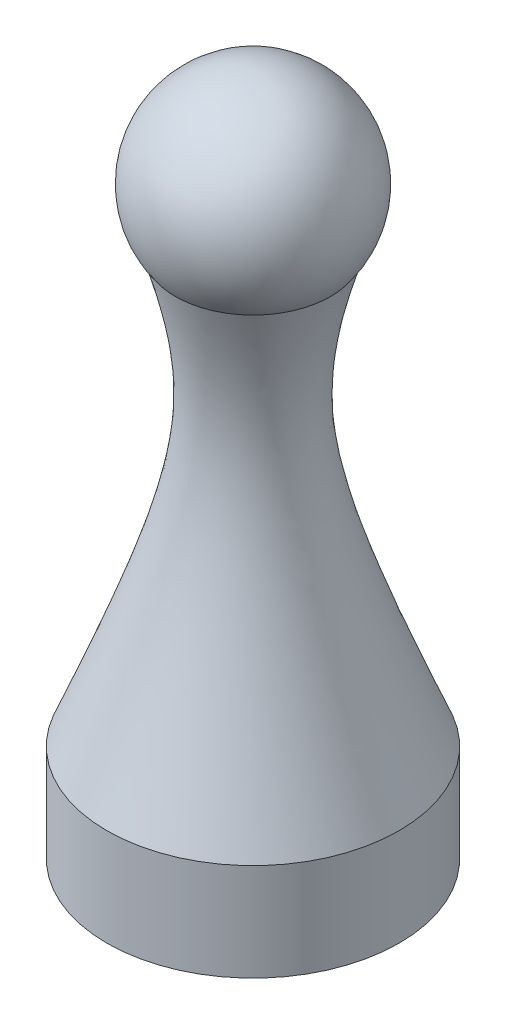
SolidWorks part; units mm, degrees
ref_plane "Front Plane" through (0, 0, 0) normal (0, 0, 1) x (1, 0, 0)
ref_plane "Top Plane" through (0, 0, 0) normal (0, 1, 0) x (1, 0, 0)
ref_plane "Right Plane" through (0, 0, 0) normal (1, 0, 0) x (0, 0, -1)
sketch "Sketch1" plane through (0, 0, 0) normal (0, 1, 0) x (1, 0, 0)
  circle A0 centre (0, 0) radius 15
extrude "Boss-Extrude1" add sketch "Sketch1" along normal blind 10
sketch "Sketch2" plane through (0, 10, 0) normal (0, 1, 0) x (1, 0, 0)
  circle A0 centre (0, 0) radius 15
ref_plane "Plane1" through (0, 60, 0) normal (0, 1, 0) x (1, 0, 0)
sketch "Sketch3" plane through (0, 60, 0) normal (0, 1, 0) x (1, 0, 0)
  circle A0 centre (0, 0) radius 10
loft "Loft1" add profiles "Sketch3", "Sketch2"
sketch "Sketch4" plane through (0, 60, 0) normal (0, 1, 0) x (1, 0, 0)
  line L0 (0, 10) -> (0, -10)
  circle A0 centre (0, 0) radius 10 construction
  arc A1 (0, 10) -> (0, -10) centre (0, 0) cw
revolve "Revolve1" add sketch "Sketch4" angle 360 about L0
sketch "Sketch5" plane through (0, 0, 0) normal (0, -1, 0) x (1, 0, 0)
  line L0 (85.3333, 256) -> (426.6667, 256) construction
  line L1 (70.3333, 241) -> (411.6667, 241) construction
  line L20 (15.5994, -12.313) -> (15.5994, 14.2765) construction
  line L22 (-1.245, 0.1172) -> (0.0322, 3.1231)
  line L23 (1.5772, 0.1172) -> (0.0322, 3.1231)
  line L24 (0.0322, 3.1231) -> (1.5772, 0.1172)
  line L25 (-6.1218, -4.2841) -> (-6.614, -5.5378)
  line L26 (-3.2456, -2.8517) -> (-3.2003, -2.4439)
  line L27 (3.6668, 0.4484) -> (0.1519, 8.6268)
  line L28 (8.8353, -7.3566) -> (6.3322, -5.7535)
  line L29 (8.8353, -7.8036) -> (8.8353, -7.3566)
  line L30 (4.3982, -7.8036) -> (8.8353, -7.8036)
  line L31 (4.5863, -6.9096) -> (4.3982, -7.8036)
  line L32 (0.0322, 5.79) -> (2.5395, -1.2019)
  line L33 (-3.2003, -2.4439) -> (0.0322, 5.79)
  line L34 (-3.7831, -7.6989) -> (-3.6565, -6.5577)
  line L35 (-3.7831, -7.9389) -> (-3.7831, -7.6989)
  line L36 (-9.1214, -7.9389) -> (-3.7831, -7.9389)
  line L37 (-9.1214, -7.4584) -> (-9.1214, -7.9389)
  line L38 (-6.614, -5.5378) -> (-9.1214, -7.4584)
  line L39 (-0.9506, 8.8879) -> (-5.2069, -1.9539)
  arc A5 (1.5772, 0.1172) -> (-1.245, 0.1172) centre (0.1661, -0.1371) cw
  arc A6 (-0.9506, 8.8879) -> (-7.728, 2.3014) centre (-1.4867, 2.6593) cw
  arc A7 (0.1519, 9.24) -> (-7.728, 0.1172) centre (0.7835, 0.7298) cw
  arc A8 (0.1519, 9.24) -> (-7.728, 0.1172) centre (-0.8426, 2.1345) cw
  arc A9 (-0.9506, 8.8879) -> (-7.728, 2.3014) centre (-1.7737, 2.9547) cw
extrude "Boss-Extrude2" add sketch "Sketch5" along normal blind 2 contours A7 A8 | L34 A7 L25 L38 L37 L36 L35 | L28 A7 L31 L30 L29 | A9 A6 | A9 L26 L33 L32 L27 L39 | A5 L23 L22
